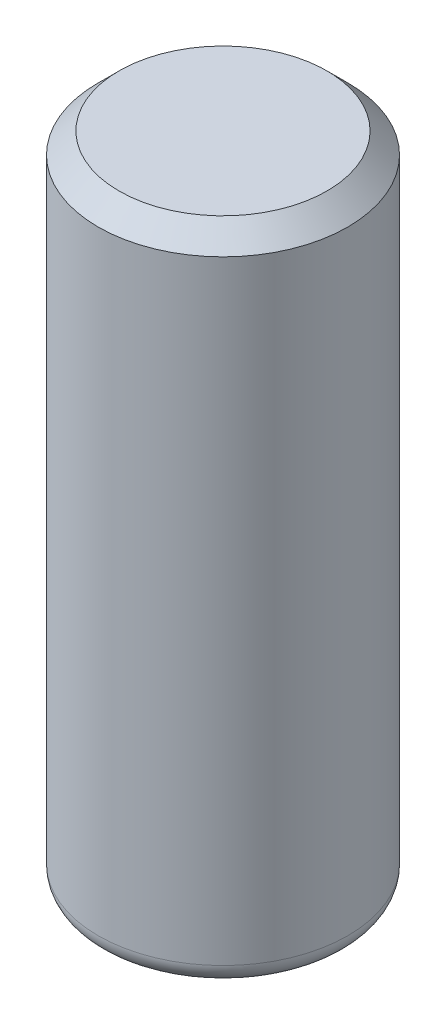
SolidWorks part; units mm, degrees
ref_plane "Front Plane" through (0, 0, 0) normal (0, 0, 1) x (1, 0, 0)
ref_plane "Top Plane" through (0, 0, 0) normal (0, 1, 0) x (1, 0, 0)
ref_plane "Right Plane" through (0, 0, 0) normal (1, 0, 0) x (0, 0, -1)
sketch "Sketch1" plane through (0, 0, 0) normal (0, 0, 1) x (1, 0, 0)
  line L0 (0, 0) -> (-1.524, 0)
  line L1 (-1.524, 0) -> (-1.524, 8.001)
  line L2 (-1.524, 8.001) -> (0, 8.001)
  line L3 (0, 8.001) -> (0, 0)
  line L4 (0, 7.983) -> (0, -2.451) construction
  dimension "D1" = 3.048
  dimension "D2" = 8.001
revolve "Revolve1" add sketch "Sketch1" angle 360 about L4
fillet "Fillet1" radius 0.254 1 edges at (0, 0, 1.524)
chamfer "Chamfer1" distance 0.254 angle 45 1 edges at (0, 8.001, 1.524)
